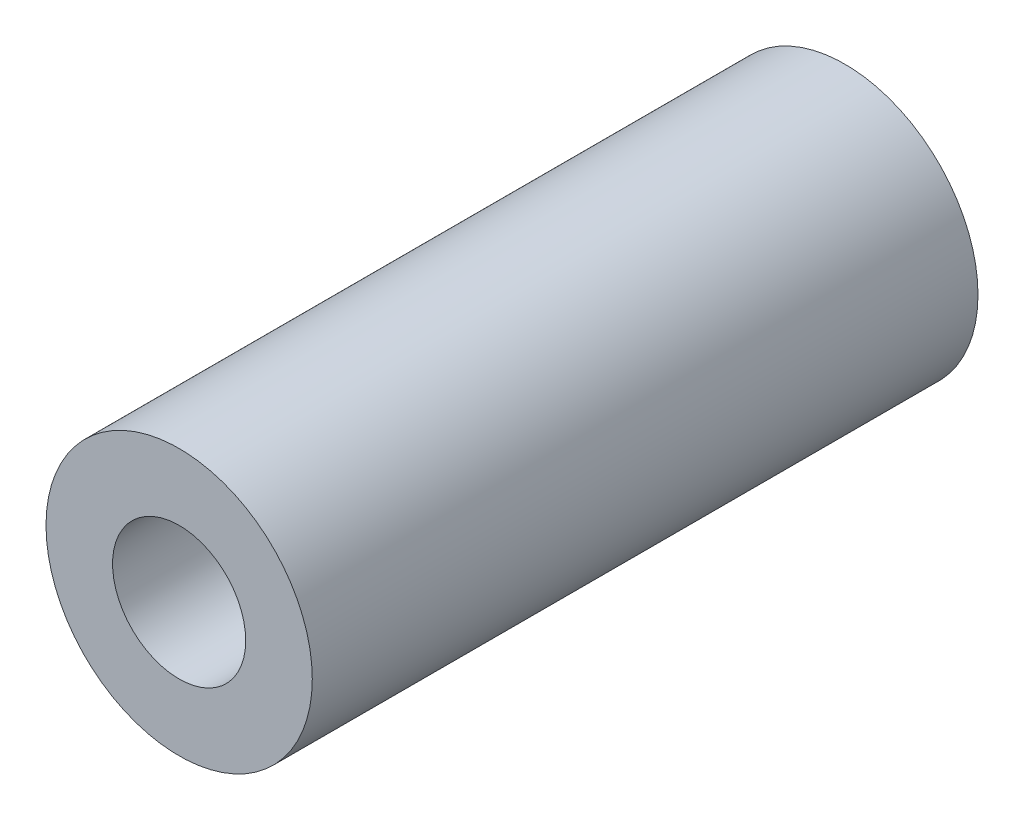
SolidWorks part; units mm, degrees
ref_plane "Plan de face" through (0, 0, 0) normal (0, 0, 1) x (1, 0, 0)
ref_plane "Plan de dessus" through (0, 0, 0) normal (0, 1, 0) x (1, 0, 0)
ref_plane "Plan de droite" through (0, 0, 0) normal (1, 0, 0) x (0, 0, -1)
sketch "Esquisse1" plane through (0, 0, 0) normal (0, 0, 1) x (1, 0, 0)
  circle A0 centre (0, 0) radius 3
  dimension "D1" = 6
extrude "Boss.-Extru.1" add sketch "Esquisse1" along normal blind 15
sketch "Esquisse2" plane through (0, 0, 15) normal (0, 0, 1) x (1, 0, 0)
  circle A0 centre (0, 0) radius 1.5
  dimension "D1" = 3
extrude "Enlèv. mat.-Extru.1" cut sketch "Esquisse2" against normal up to next
